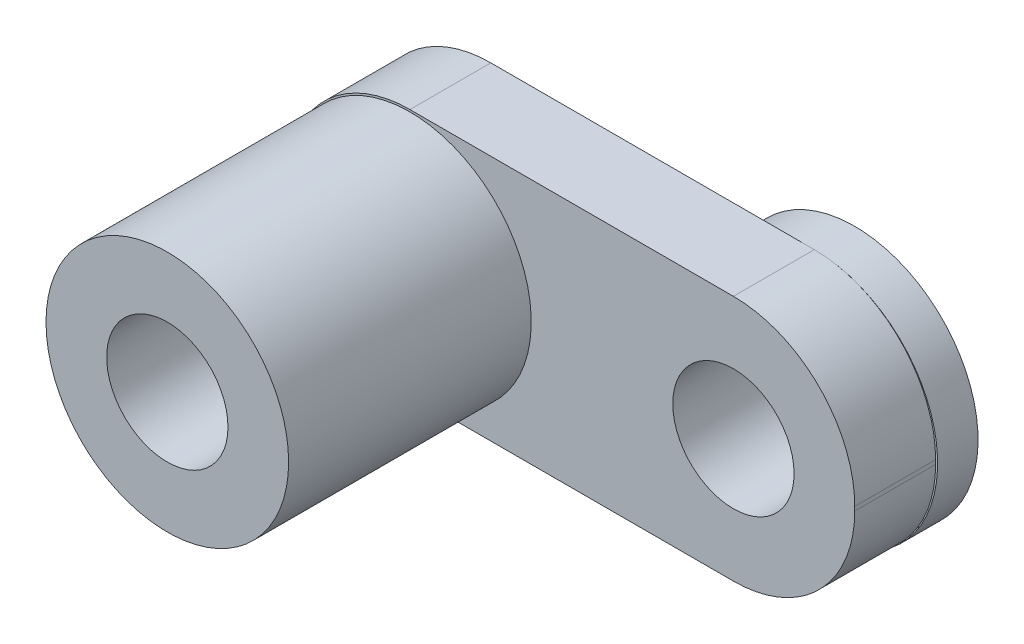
SolidWorks part; units mm, degrees
ref_plane "Plan de face" through (0, 0, 0) normal (0, 0, 1) x (1, 0, 0)
ref_plane "Plan de dessus" through (0, 0, 0) normal (0, 1, 0) x (1, 0, 0)
ref_plane "Plan de droite" through (0, 0, 0) normal (1, 0, 0) x (0, 0, -1)
sketch "Esquisse1" plane through (0, 0, 0) normal (0, 0, 1) x (1, 0, 0)
  line L1 (3, 0) -> (11, 0)
  line L2 (0, 3) -> (0, 3.1)
  line L3 (3, 6.1) -> (11, 6.1)
  line L4 (14, 3) -> (14, 3.1)
  arc A0 (0, 3.1) -> (3, 6.1) centre (3, 3.1) cw
  arc A1 (3, 0) -> (0, 3) centre (3, 3) cw
  arc A2 (11, 6.1) -> (14, 3.1) centre (11, 3.1) cw
  arc A3 (11, 0) -> (14, 3) centre (11, 3) ccw
  point P6 (0, 6.1)
  point P9 (0, 0)
  point P12 (14, 6.1)
  dimension "D3" = 3
  dimension "D1" = 6.1
  dimension "D2" = 14
extrude "Extrusion1" add sketch "Esquisse1" along normal blind 2
sketch "Esquisse2" plane through (0, 0, 2) normal (0, 0, 1) x (1, 0, 0)
  line L8 (11, 6.1) -> (3, 6.1) construction
  circle A0 centre (3, 3.05) radius 3
  dimension "D1" = 6
  dimension "D3" = 3.05
  dimension "D2" = 3
extrude "Extrusion2" add sketch "Esquisse2" along normal blind 6
sketch "Esquisse3" plane through (0, 0, 0) normal (0, 0, -1) x (-1, 0, 0)
  line L1 (-11, 6.1) -> (-3, 6.1) construction
  circle A0 centre (-11, 3.05) radius 3.05
  dimension "D1" = 6.1
  dimension "D3" = 3.05
  dimension "D2" = 3
extrude "Extrusion3" add sketch "Esquisse3" along normal blind 1
sketch "Esquisse4" plane through (0, 0, 2) normal (0, 0, 1) x (1, 0, 0)
  line L1 (11, 6.1) -> (3, 6.1) construction
  circle A0 centre (3, 3.05) radius 1.5
  circle A1 centre (11, 3.05) radius 1.5
  circle A8 centre (3, 3.05) radius 3 construction
  dimension "D1" = 3
  dimension "D2" = 3.05
  dimension "D3" = 3
  dimension "D5" = 3
  dimension "D6" = 3.05
  dimension "D4" = 3
extrude "Enlèv. mat.-Extru.1" cut sketch "Esquisse4" against normal through all and the other way through all
